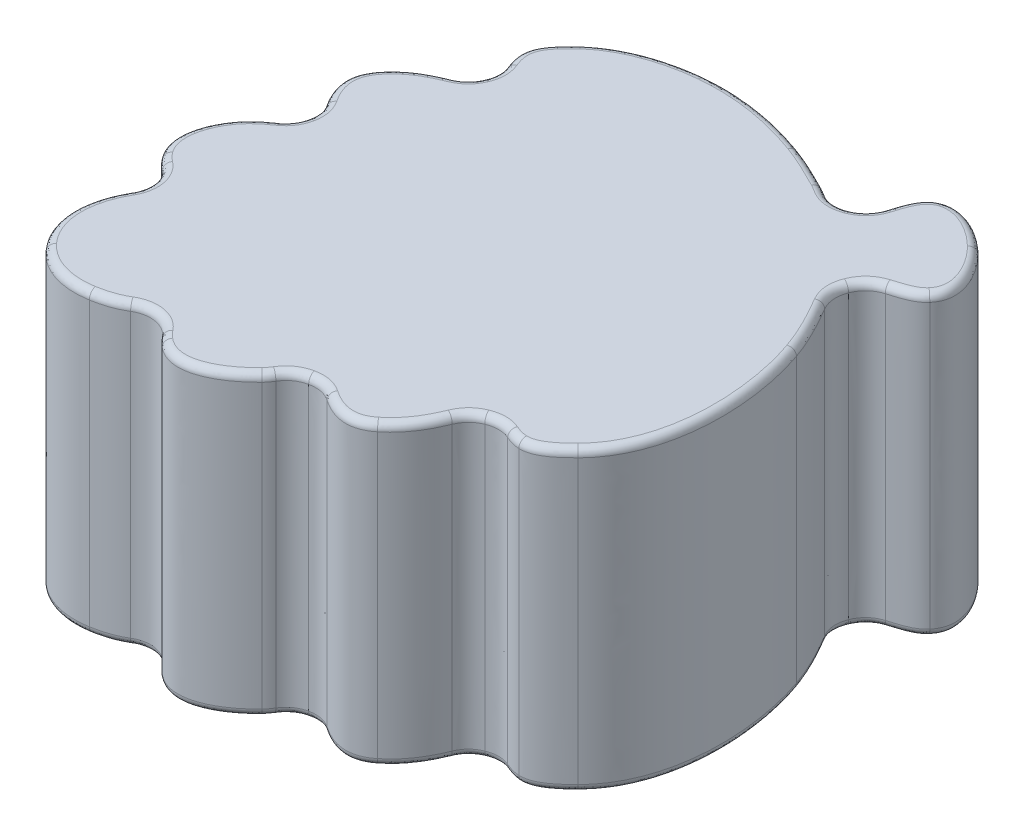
SolidWorks part; units mm, degrees
ref_plane "Front Plane" through (0, 0, 0) normal (0, 0, 1) x (1, 0, 0)
ref_plane "Top Plane" through (0, 0, 0) normal (0, 1, 0) x (1, 0, 0)
ref_plane "Right Plane" through (0, 0, 0) normal (1, 0, 0) x (0, 0, -1)
body saved out of another part "Stock-Wooden Clock Video-1"
fillet "Fillet1" radius 0.5 76 edges
